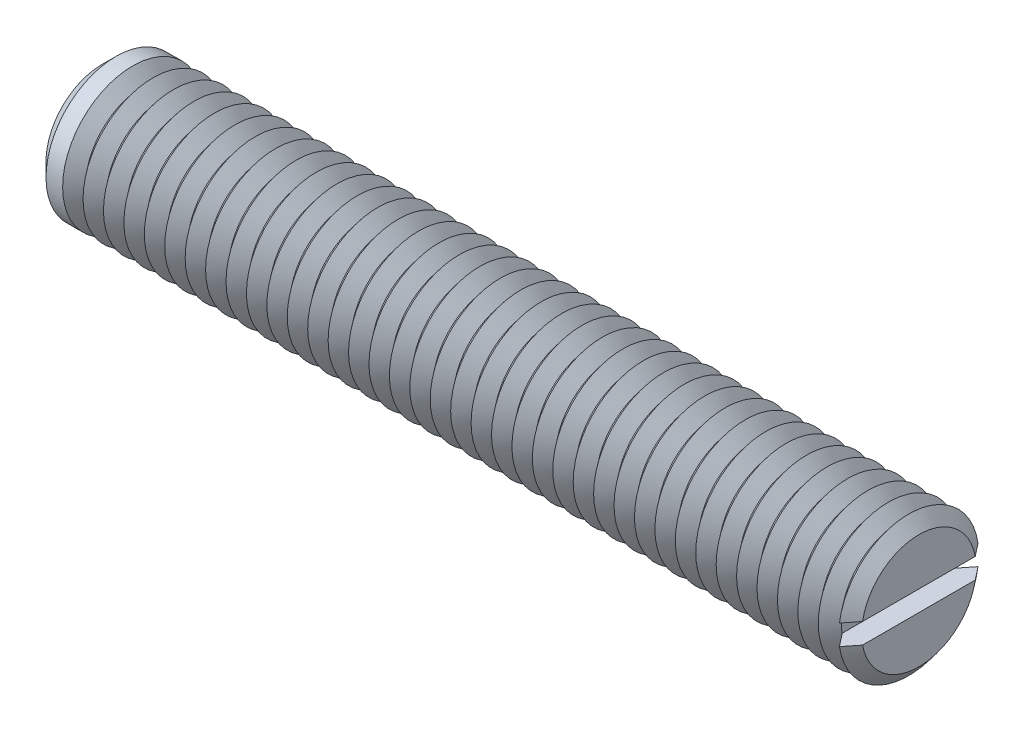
SolidWorks part; units mm, degrees
ref_plane "Front Plane" through (0, 0, 0) normal (0, 0, 1) x (1, 0, 0)
ref_plane "Top Plane" through (0, 0, 0) normal (0, 1, 0) x (1, 0, 0)
ref_plane "Right Plane" through (0, 0, 0) normal (1, 0, 0) x (0, 0, -1)
sketch "Sketch1" plane through (0, 0, 0) normal (1, 0, 0) x (0, 0, -1)
  circle A0 centre (0, 0) radius 6
  dimension "D1" = 12
extrude "Extrude1" add sketch "Sketch1" along normal mid plane 70
sketch "Sketch2" plane through (0, 0, 0) normal (0, 0, 1) x (1, 0, 0)
  line L0 (35, 0.875) -> (33.25, 0.875)
  line L1 (35, -6) -> (35, 6) construction
  line L2 (33.25, 0.875) -> (33.25, -0.875)
  line L3 (0, 0) -> (50000, 0) construction
  line L4 (35, -0.875) -> (33.25, -0.875)
  line L5 (35, -0.875) -> (35, 0.875)
  point P9 (33.25, 0)
  dimension "D1" = 1.75
extrude "Extrude2" cut sketch "Sketch2" against normal mid plane 18
chamfer "Chamfer1" distance 1.2 angle 45 1 edges at (-35, 0, -6)
sketch "Sketch3" plane through (0, 0, 0) normal (0, 0, 1) x (1, 0, 0)
  line L0 (0, 0) -> (30.9602, 0) construction
  line L1 (34.125, -6) -> (35.875, -6)
  line L2 (-33.8, -6) -> (35, -6) construction
  line L3 (35.875, -6) -> (35, -4.9071)
  line L4 (35, -6) -> (35, -0.875) construction
  line L5 (35, -4.9071) -> (34.125, -6)
  dimension "D1" = 1.75
  dimension "D2" = 1.4
revolve "Cut-Revolve1" cut sketch "Sketch3" angle 360 about L0
pattern_linear "LPattern1" count 39 spacing 1.75 along (-1, 0, 0) of "Cut-Revolve1"
equation "\"D2@Sketch3\" = \"D1@Sketch3\"*0.8"
